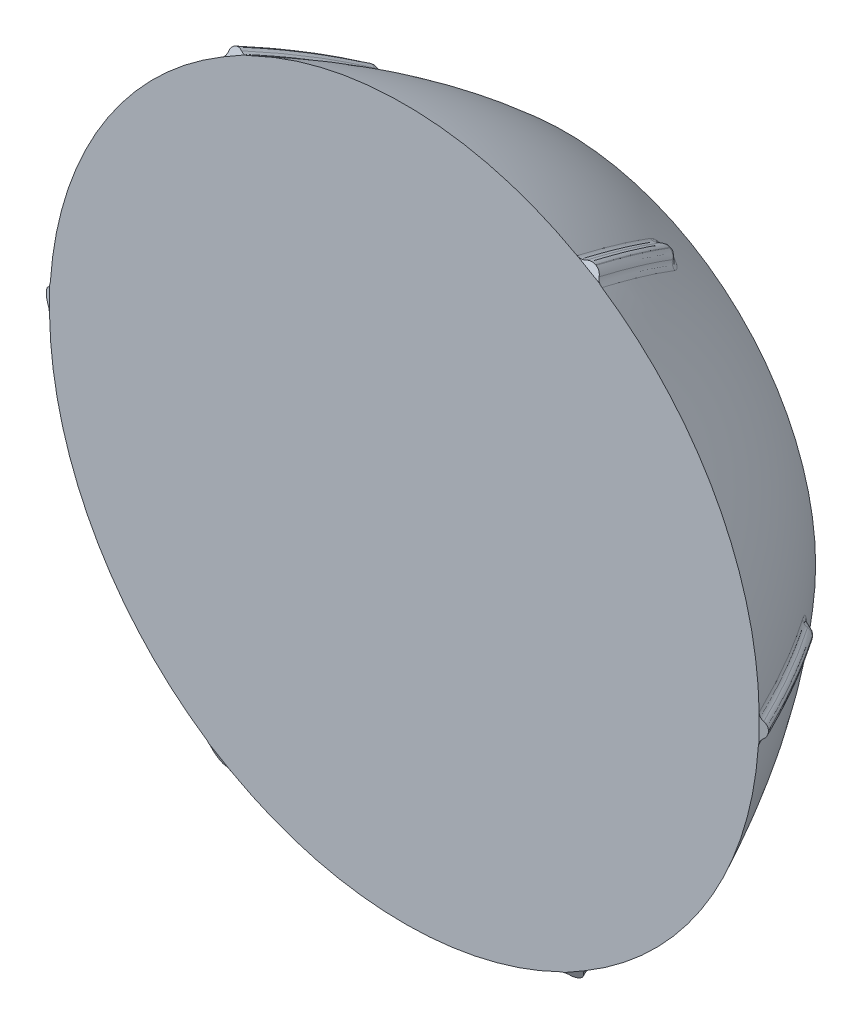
SolidWorks part; units mm, degrees
ref_plane "Front Plane" through (0, 0, 0) normal (0, 0, 1) x (1, 0, 0)
ref_plane "Top Plane" through (0, 0, 0) normal (0, 1, 0) x (1, 0, 0)
ref_plane "Right Plane" through (0, 0, 0) normal (1, 0, 0) x (0, 0, -1)
body saved out of another part "ECOSTEM-3D BLADE-HUB BASE PART"
sketch "Sketch1" plane through (0, 0, 0) normal (0, 1, 0) x (1, 0, 0)
  spline S0 degree 3 poles (-1577.1285, 2591.8026) (1560.1688, -2722.8165) (-1733.8988, 2663.7698) (1913.3111, -2253.2439) knots -21.925213 -21.925213 -21.925213 -21.925213 20.15202 20.15202 20.15202 20.15202 only from (-19.558, 28.8036) to (-13.7795, 37.6936)
  spline S1 degree 3 poles (-696.3957, -666.3298) (614.9154, 949.4445) (-508.6585, -963.8079) (563.7483, 867.7512) knots -12.84739 -12.84739 -12.84739 -12.84739 16.700661 16.700661 16.700661 16.700661 only from (13.7795, 37.6936) to (19.558, 28.8036)
  spline S2 degree 3 poles (-13.7795, 37.6936) (-16.1285, 35.0559) (-17.9948, 31.9986) (-19.558, 28.8036) knots 0.276625 0.276625 0.276625 0.276625 0.467744 0.467744 0.467744 0.467744 construction
  spline S3 degree 3 poles (-19.558, 28.8036) (-18.5234, 30.9183) (-17.356, 32.9726) (-16.0037, 34.8849) knots 0 0 0 0 0.661866 0.661866 0.661866 0.661866
extrude "Extrude-Thin1" add sketch "Sketch1" along normal blind 1.016 thin
sketch "Sketch2" plane through (0, 0, -28.8036) normal (0, 0, 1) x (1, 0, 0)
  circle A0 centre (0, 0) radius 29.1743
extrude "Cut-Extrude1" cut sketch "Sketch2" along normal through all
fillet "Fillet1" radius 0.508 2 edges at (-16.1592, 0, -34.9949) (-16.1485, 1.016, -34.9873)
fillet "Fillet2" radius 0.508 4 edges at (-16.3789, 0.1907, -35.0139) (-16.4245, 0.9047, -34.9489)
fillet "Fillet3" radius 0.508 4 edges at (-16.1131, 0.1113, -34.7287) (-16.0537, 0.8254, -34.7838)
pattern_circular "CirPattern3" count 6 over 360 of "Extrude-Thin1", "Cut-Extrude1", "Fillet1", "Fillet2", "Fillet3"
